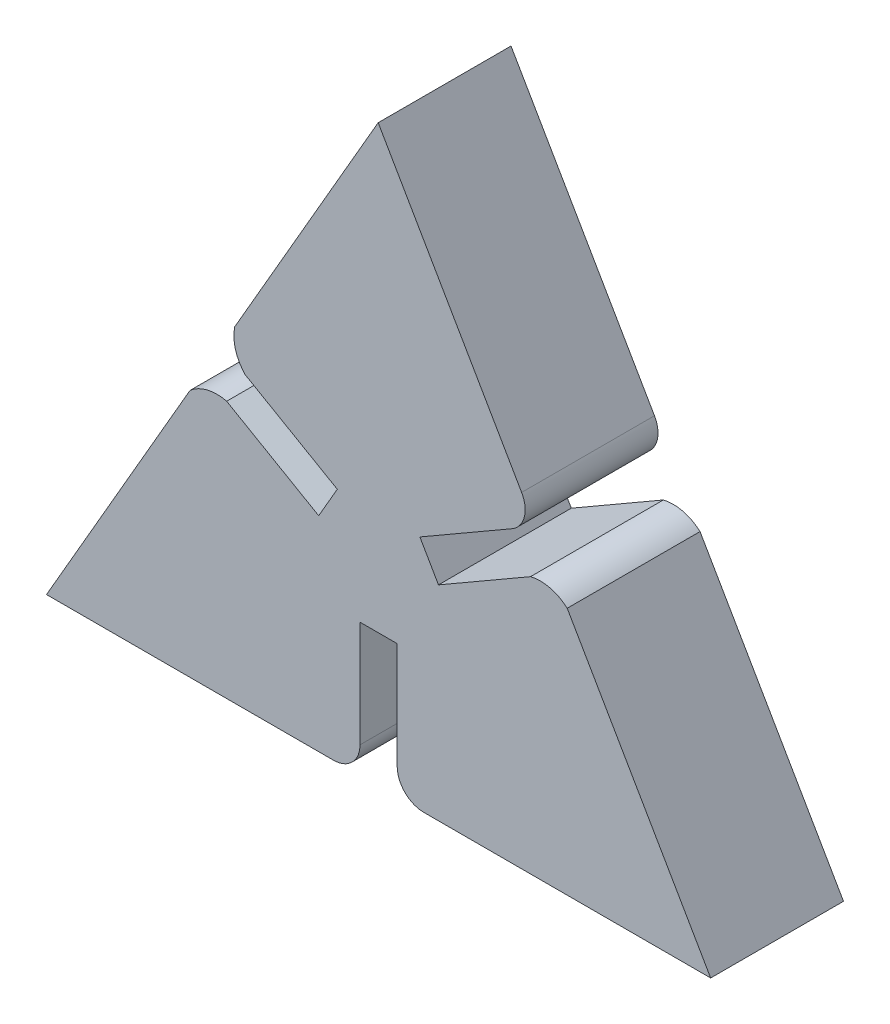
SolidWorks part; units mm, degrees
ref_plane "Front Plane" through (0, 0, 0) normal (0, 0, 1) x (1, 0, 0)
ref_plane "Top Plane" through (0, 0, 0) normal (0, 1, 0) x (1, 0, 0)
ref_plane "Right Plane" through (0, 0, 0) normal (1, 0, 0) x (0, 0, -1)
sketch "Sketch1" plane through (0, 0, 0) normal (0, 0, 1) x (1, 0, 0)
  line L0 (-14.2, -8.1594) -> (-25, -26.8656)
  line L1 (-4.5091, -11.4804) -> (-3.1091, -9.0555)
  line L2 (-25, -26.8656) -> (-3.4, -26.8656)
  line L3 (-1.4, -16.8656) -> (1.4, -16.8656)
  line L4 (-3.8091, -10.268) -> (-13.2401, -4.823) construction
  line L5 (0, -16.5482) -> (0, -36.0463) construction
  line L6 (3.5343, -10.4266) -> (20.4201, -0.6776) construction
  line L7 (3.1091, -9.0555) -> (10.0373, -5.0555)
  line L8 (-3.1091, -9.0555) -> (-10.0373, -5.0555)
  line L9 (-4.5091, -11.4804) -> (-11.4373, -7.4804)
  line L11 (-0.0306, 16.3827) -> (10.7694, -2.3235)
  line L12 (-10.8306, -2.3235) -> (-0.0306, 16.3827)
  line L13 (1.4, -16.8656) -> (1.4, -24.8656)
  line L14 (-1.4, -16.8656) -> (-1.4, -24.8656)
  line L15 (4.5091, -11.4804) -> (11.4373, -7.4804)
  line L16 (25, -26.8656) -> (3.4, -26.8656)
  line L17 (4.5091, -11.4804) -> (3.1091, -9.0555)
  line L18 (14.2, -8.1594) -> (25, -26.8656)
  line L19 (-1.4, -12.6235) -> (-1.4, -36.0463) construction
  line L21 (0, -12.6235) -> (0, -36.0463) construction
  arc A0 (-14.2, -8.1594) -> (-11.4373, -7.4804) centre (-12.1751, -10.4384) cw
  arc A1 (10.0373, -5.0555) -> (10.7694, -2.3235) centre (9.0373, -3.3235) ccw
  arc A2 (-10.8306, -2.3235) -> (-10.0373, -5.0555) centre (-7.8445, -2.9376) ccw
  arc A3 (1.4, -24.8656) -> (3.4, -26.8656) centre (3.4, -24.8656) ccw
  arc A4 (-1.4, -24.8656) -> (-3.4, -26.8656) centre (-3.4, -24.8656) cw
  arc A5 (14.2, -8.1594) -> (11.4373, -7.4804) centre (12.1751, -10.4384) ccw
  point P0 (0, 16.4357)
  point P1 (-35.5296, -0.3486)
  point P2 (0, -3.5643)
  point P3 (25, -26.8656)
  point P5 (3.3885, -19.8077)
  point P6 (2.6937, -16.7666)
  point P7 (30.5221, -2.8524)
  point P11 (-7.6795, -16.8656)
  point P12 (7.6795, -16.8656)
  point P13 (10, -12.6235)
  point P14 (10, -36.0463)
  point P15 (-36.1557, -1.6008)
  point P17 (2.7624, -21.0599)
  point P20 (3.3198, -18.0188)
  point P21 (31.1482, -4.1046)
  point P53 (0, -16.8656)
  point P54 (0, -16.8656)
extrude "Boss-Extrude3" add sketch "Sketch1" along normal blind 10
equation "\"A\"=8"
equation "\"D3@Sketch1\"= \"A\""
equation "\"B\"= \"A\" * 7 / 40"
equation "\"D2@Sketch1\"=\"B\""
equation "\"D4@Sketch1\" = \"A\" * 2.7"
equation "\"D5@Sketch1\"= \"A\" * 2.7"
